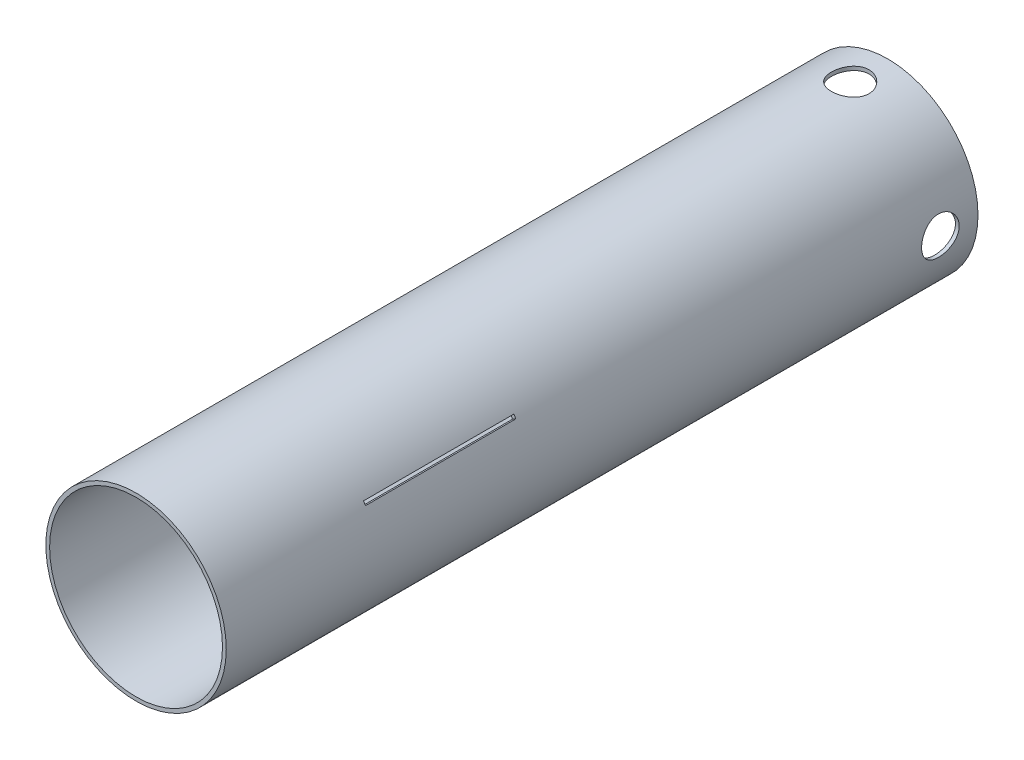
SolidWorks part; units mm, degrees
ref_plane "Plan de face" through (0, 0, 0) normal (0, 0, 1) x (1, 0, 0)
ref_plane "Plan de dessus" through (0, 0, 0) normal (0, 1, 0) x (1, 0, 0)
ref_plane "Plan de droite" through (0, 0, 0) normal (1, 0, 0) x (0, 0, -1)
sketch "Esquisse1" plane through (0, 0, 0) normal (0, 0, 1) x (1, 0, 0)
  circle A0 centre (0, 0) radius 230
  circle A1 centre (0, 0) radius 240
  dimension "D1" = 480
  dimension "D2" = 460
extrude "Boss.-Extru.1" add sketch "Esquisse1" along normal blind 2000
sketch "Esquisse2" plane through (0, 0, 0) normal (0, 1, 0) x (1, 0, 0)
  circle A0 centre (0, -100) radius 50
  dimension "D2" = 100
  dimension "D1" = 100
extrude "Enlèv. mat.-Extru.1" cut sketch "Esquisse2" against normal through all
pattern_circular "Répétition circulaire1" count 4 over 360 about axis through (0, 0, 2000) along (0, 0, -1) of "Enlèv. mat.-Extru.1"
sketch "Esquisse3" plane through (0, 0, 0) normal (0, 1, 0) x (1, 0, 0)
  line L0 (-240, -2000) -> (240, -2000) construction
  line L1 (-5, -1200) -> (5, -1200)
  line L2 (-5, -1200) -> (-5, -1600)
  line L3 (-5, -1600) -> (5, -1600)
  line L4 (5, -1200) -> (5, -1600)
  dimension "D1" = 400
  dimension "D2" = 400
  dimension "D3" = 5
  dimension "D4" = 10
extrude "Enlèv. mat.-Extru.2" cut sketch "Esquisse3" against normal through all
pattern_circular "Répétition circulaire2" count 3 over 360 about axis through (0, 0, 0) along (0, 0, 1) of "Enlèv. mat.-Extru.2"
